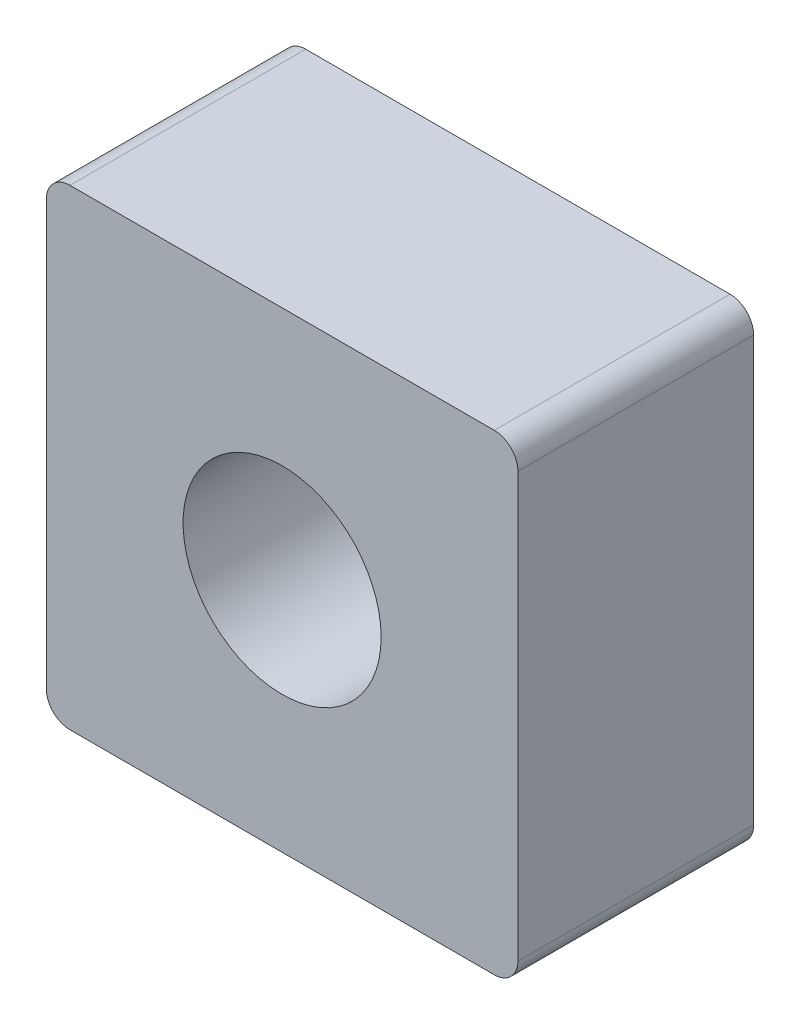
SolidWorks part; units mm, degrees
ref_plane "正面" through (0, 0, 0) normal (0, 0, 1) x (1, 0, 0)
ref_plane "平面" through (0, 0, 0) normal (0, 1, 0) x (1, 0, 0)
ref_plane "右側面" through (0, 0, 0) normal (1, 0, 0) x (0, 0, -1)
sketch "ｽｹｯﾁ1" plane through (0, 0, 0) normal (0, 0, 1) x (1, 0, 0)
  line L1 (-5, 5) -> (5, 5)
  line L2 (-5, 5) -> (-5, -5)
  line L3 (-5, -5) -> (5, -5)
  line L4 (5, 5) -> (5, -5)
  dimension "D1" = 5
  dimension "D2" = 10
  dimension "D3" = 5
  dimension "D4" = 10
extrude "押し出し1" add sketch "ｽｹｯﾁ1" along normal mid plane 5
hole_wizard "M5x0.8 ねじ穴1" positions "3Dｽｹｯﾁ1" profile "ｽｹｯﾁ3" tap size "M5x0.8" standard "JIS"
sketch3d "3Dｽｹｯﾁ1"
  line L0 (-5, 5, 2.5) -> (-5, -5, 2.5) construction
  line L1 (-5, -5, 2.5) -> (5, -5, 2.5) construction
  point P0 (0, 0, 2.5)
  dimension "D1" = 5
  dimension "D2" = 5
sketch "ｽｹｯﾁ3" plane through (0, 0, 2.5) normal (1, 0, 0) x (0, -1, 0)
  line L0 (0, 0) -> (0, 5)
  line L1 (0, 5) -> (2.1, 5)
  line L2 (2.1, 5) -> (2.1, 0)
  line L5 (2.1, 0) -> (0, 0)
  line L11 (0, -6.35) -> (0, 107.95) construction
  dimension "次ｻｰﾌｪｽまでのねじ下穴ﾄﾞﾘﾙの直径" = 4.2
  dimension "次ｻｰﾌｪｽまでのねじ下穴ﾄﾞﾘﾙの深さ" = 5
fillet "ﾌｨﾚｯﾄ1" radius 0.5 4 edges at (-5, 5, 0) (-5, -5, 0) (5, -5, 0) (5, 5, 0)
